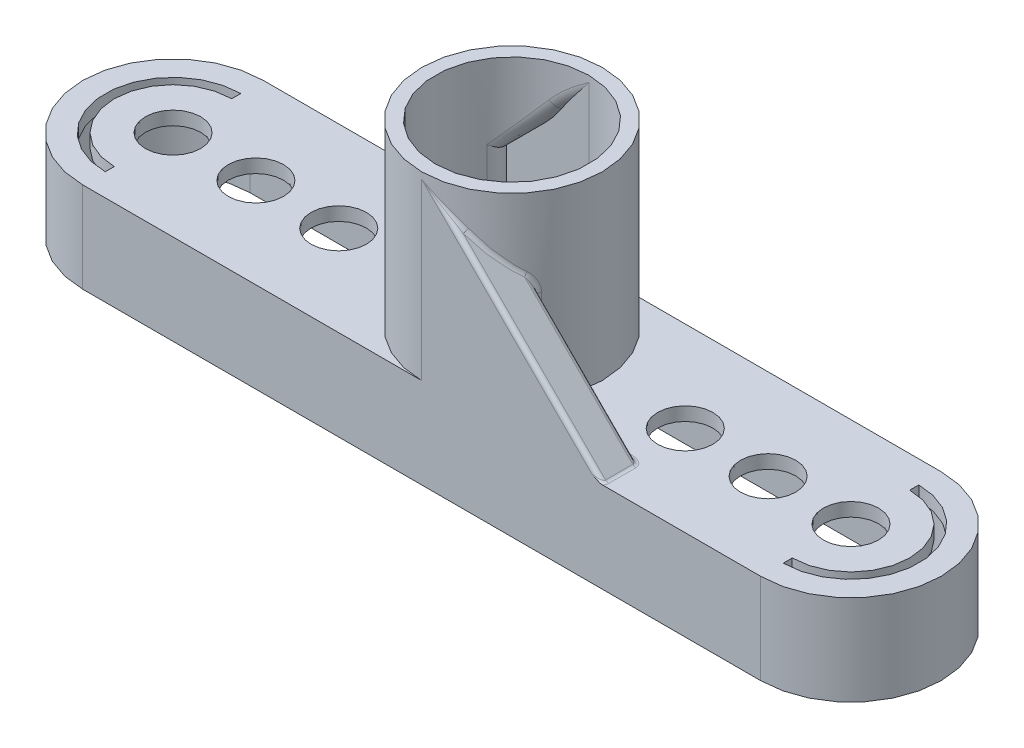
SolidWorks part; units mm, degrees
ref_plane "Alzado" through (0, 0, 0) normal (0, 0, 1) x (1, 0, 0)
ref_plane "Planta" through (0, 0, 0) normal (0, 1, 0) x (1, 0, 0)
ref_plane "Vista lateral" through (0, 0, 0) normal (1, 0, 0) x (0, 0, -1)
sketch "Croquis1" plane through (0, 0, 0) normal (0, 1, 0) x (1, 0, 0)
  line L0 (-75, 0) -> (75, 0) construction
  line L1 (-75, 20) -> (75, 20)
  line L2 (-75, -20) -> (75, -20)
  arc A0 (-75, 20) -> (-75, -20) centre (-75, 0) ccw
  arc A1 (75, -20) -> (75, 20) centre (75, 0) ccw
  point P2 (0, 0)
  dimension "D2" = 20
  dimension "D1" = 150
extrude "Base Elíptica" add sketch "Croquis1" along normal blind 20
sketch "Croquis2" plane through (0, 20, 0) normal (0, 1, 0) x (1, 0, 0)
  line L0 (-75, -20) -> (75, -20) construction
  circle A0 centre (0, 0) radius 20
extrude "Saliente Cilíndrica" add sketch "Croquis2" along normal blind 40
sketch "Croquis3" plane through (0, 0, 20) normal (0, 0, 1) x (1, 0, 0)
  line L0 (40, 20) -> (0, 60)
  line L1 (0, 20) -> (75, 20) construction
  line L3 (20, 60) -> (-20, 60) construction
  line L4 (0, 60) -> (0, 20)
  line L5 (0, 20) -> (40, 20)
  line L6 (-75, 20) -> (0, 20) construction
  dimension "D1" = 45
extrude "Nervio" add sketch "Croquis3" against normal blind 8
fillet "Redondeo Exterior Nervio" radius 1 2 edges at (8.9443, 51.0557, 17.8885) (20, 40, 20)
fillet "Redondeo Interior Nervio" radius 1 7 edges at (39.5858, 20, 19.7071) (40, 20, 15.5) (16, 32, 12) (4.7974, 55.0744, 19.4161) (28, 20, 12) (28, 32, 12) (11.6602, 48.3398, 16.2493)
pattern_circular "Matriz Nervio" count 2 over 360 about axis through (0, 60, 0) along (0, 1, 0) of "Nervio"
fillet "Redondeo Exterior Nervio 2" radius 1 2 edges at (-8.9443, 51.0557, -17.8885) (-20, 40, -20)
fillet "Redondeo Interior Nervio 2" radius 1 7 edges at (-4.7974, 55.0744, -19.4161) (-11.6602, 48.3398, -16.2493) (-39.5858, 20, -19.7071) (-40, 20, -15.5) (-16, 32, -12) (-28, 20, -12) (-28, 32, -12)
shell "Vaciado" thickness 3
sketch "Croquis5" plane through (0, 20, 0) normal (0, 1, 0) x (1, 0, 0)
  arc A8 (-75, 15) -> (-75, -15) centre (-75, 0) ccw
  arc A9 (-75, 15) -> (-75, -15) centre (-75, 0) ccw
  arc A11 (75, -15) -> (75, 15) centre (75, 0) ccw
  arc A12 (75, -15) -> (75, 15) centre (75, 0) ccw
  dimension "D1" = 5
  dimension "D2" = 5
extrude "Corte" cut sketch "Croquis5" against normal blind 20 thin
hole_wizard "Refrentado para tornillo con cabeza hueca hexagonal de M51" positions "Croquis7" profile "Croquis6" counterbore size "M5" standard "Ansi Metric"
sketch "Croquis7" plane through (0, 20, 0) normal (0, 1, 0) x (1, 0, 0)
  arc A4 (75, -13) -> (75, 13) centre (75, 0) ccw construction
  point P1 (75, 0)
  point P4 (56.6667, 0)
  point P6 (38.3333, 0)
  dimension "D1" = 18.3333
  dimension "D2" = 18.3333
sketch "Croquis6" plane through (75, 20, 0) normal (1, 0, 0) x (0, 0, 1)
  line L0 (0, 0) -> (0, 20)
  line L1 (0, 20) -> (2.75, 20)
  line L3 (2.75, 20) -> (2.75, 3.65)
  line L4 (2.75, 3.65) -> (6.12, 3.65)
  line L5 (6.12, 3.65) -> (6.12, 0)
  line L7 (6.12, 0) -> (0, 0)
  line L11 (0, -6.35) -> (0, 107.95) construction
  dimension "Diámetro de taladro hasta el siguiente" = 5.5
  dimension "Profundidad de taladro hasta el siguiente" = 20
  dimension "Diámetro de refrentado" = 12.24
  dimension "Profundidad de refrentado" = 3.65
mirror "Simetria Refrentado" about plane through (0, 0, 0) normal (1, 0, 0) of "Refrentado para tornillo con cabeza hueca hexagonal de M51"
